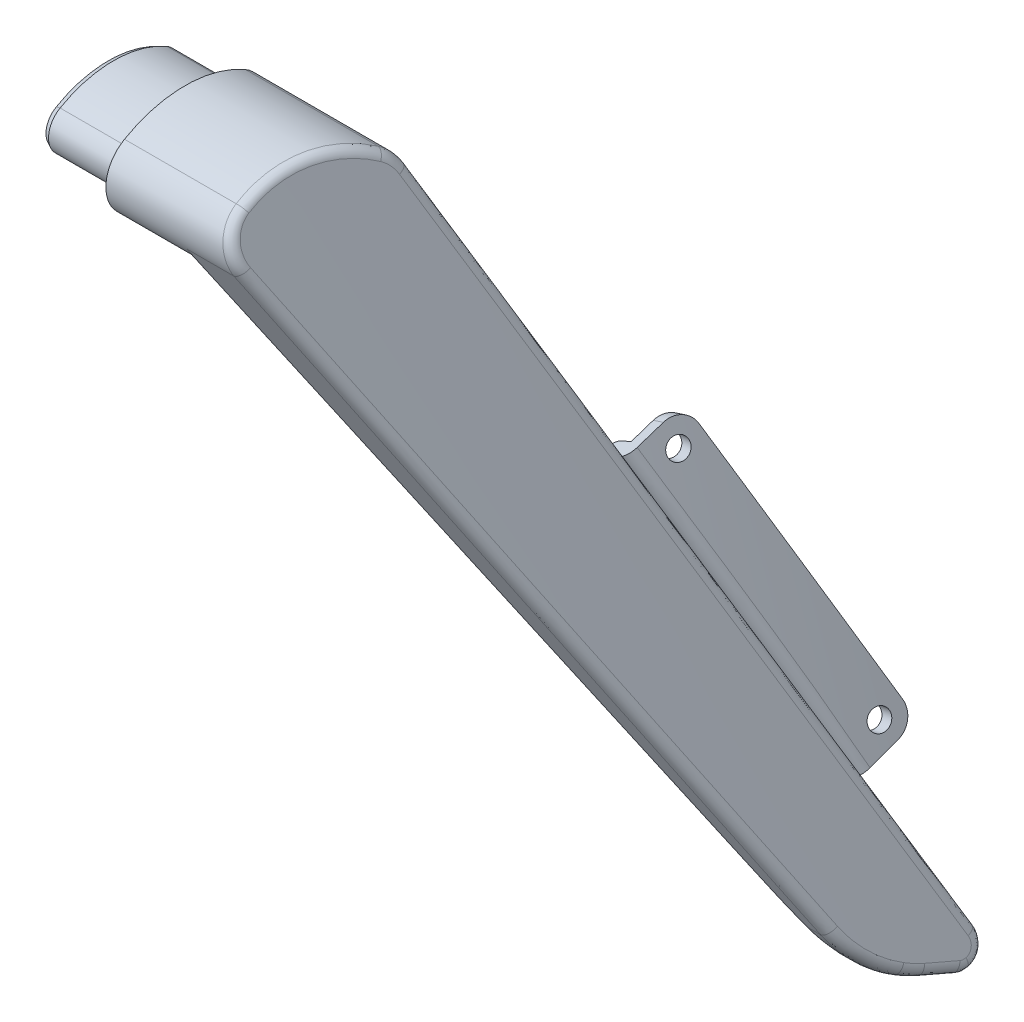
SolidWorks part; units mm, degrees
other "<Graffic_204>-<Congé6>"
ref_plane "Plan de face" through (0, 0, 0) normal (0, 0, 1) x (1, 0, 0)
ref_plane "Plan de dessus" through (0, 0, 0) normal (0, 1, 0) x (1, 0, 0)
ref_plane "Plan de droite" through (0, 0, 0) normal (1, 0, 0) x (0, 0, -1)
mirrored part "Graffic_204_Symétrique"
